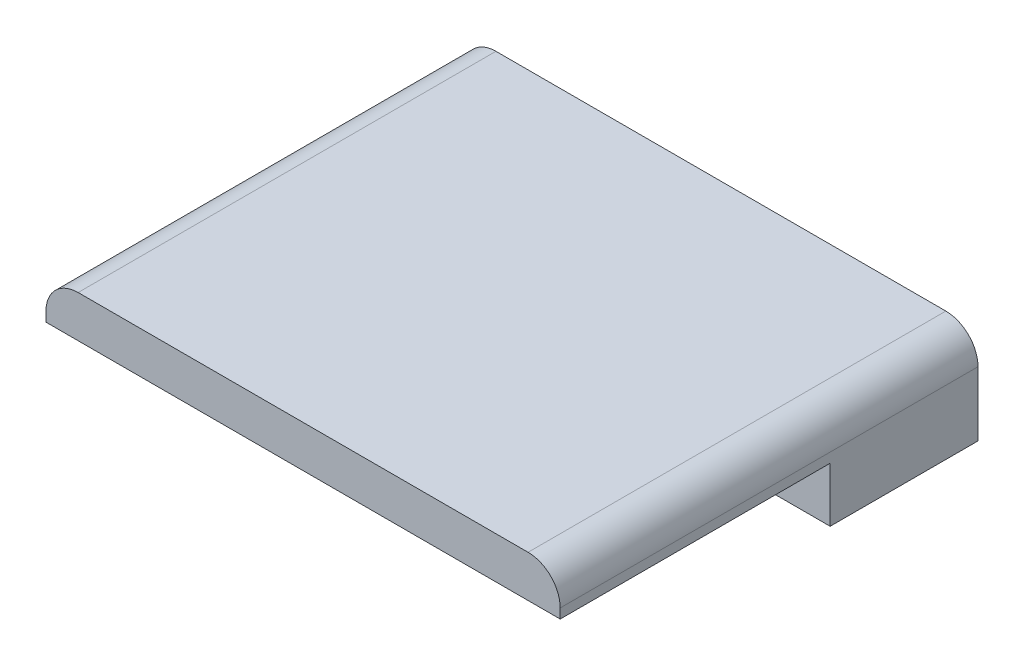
SolidWorks part; units mm, degrees
ref_plane "Vorderansicht" through (0, 0, 0) normal (0, 0, 1) x (1, 0, 0)
ref_plane "Draufsicht" through (0, 0, 0) normal (0, 1, 0) x (1, 0, 0)
ref_plane "Seitenansicht" through (0, 0, 0) normal (1, 0, 0) x (0, 0, -1)
sketch "Skizze1" plane through (0, 0, 0) normal (0, 0, 1) x (1, 0, 0)
  line L1 (-40, 0) -> (40, 0)
  line L2 (-40, 0) -> (-40, 15)
  line L3 (-40, 15) -> (40, 15)
  line L4 (40, 0) -> (40, 15)
  point P4 (0, 0)
  dimension "D1" = 15
  dimension "D2" = 80
extrude "Linear austragen1" add sketch "Skizze1" along normal blind 65
sketch "Skizze2" plane through (40, 0, 0) normal (1, 0, 0) x (0, 0, -1)
  line L0 (-65, 0) -> (0, 0) construction
  line L1 (-65, 0) -> (-65, 15) construction
  line L2 (-65, 0) -> (-23, 0)
  line L3 (-65, 0) -> (-65, 8.5)
  line L4 (-65, 8.5) -> (-23, 8.5)
  line L5 (-23, 8.5) -> (-23, 0)
  dimension "D1" = 42
  dimension "D2" = 8.5
extrude "Schnitt-Linear austragen1" cut sketch "Skizze2" against normal through all
fillet "Verrundung1" radius 5
